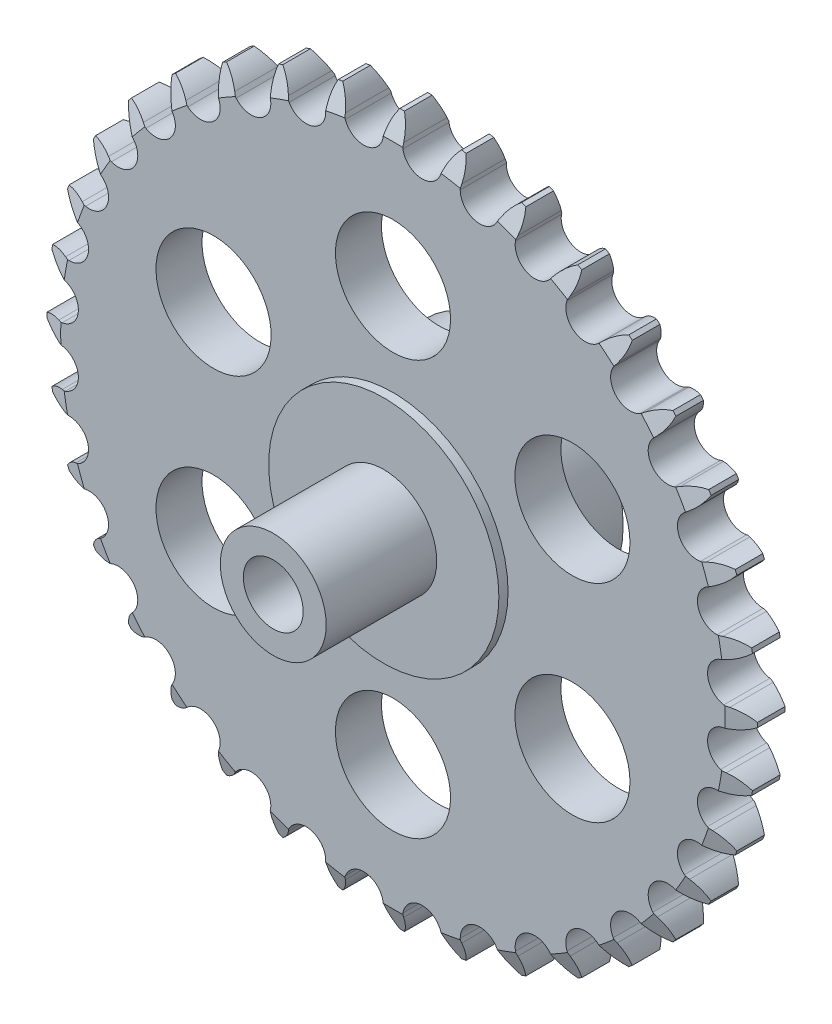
SolidWorks part; units mm, degrees
ref_plane "Front Plane" through (0, 0, 0) normal (0, 0, 1) x (1, 0, 0)
ref_plane "Top Plane" through (0, 0, 0) normal (0, 1, 0) x (1, 0, 0)
ref_plane "Right Plane" through (0, 0, 0) normal (1, 0, 0) x (0, 0, -1)
sketch "Sketch1" plane through (0, 0, 0) normal (0, 0, 1) x (1, 0, 0)
  line L0 (0, 0) -> (0, 72.8581) construction
  line L1 (-2.1568, 71.8581) -> (2.1568, 71.8581) construction
  line L2 (-2.1568, 71.8581) -> (-2.0429, 72.8581) construction
  line L3 (2.1568, 71.8581) -> (2.0429, 72.8581) construction
  line L4 (-2.0429, 72.8581) -> (2.0429, 72.8581) construction
  line L7 (-0.5, 77.163) -> (0.5, 77.163) construction
  circle A0 centre (0, 0) radius 72.8581 construction
  circle A1 centre (6.35, 72.5808) radius 4.255 construction
  circle A2 centre (-6.35, 72.5808) radius 4.255 construction
  circle A3 centre (0, 0) radius 68.6031 construction
  arc A4 (-2.0429, 72.8581) -> (-0.5, 77.163) centre (7.8928, 71.726) cw construction
  arc A5 (2.0429, 72.8581) -> (0.5, 77.163) centre (-7.8928, 71.726) ccw construction
  dimension "D1" = 13
  dimension "SprocketPitchDiameter" = 145.7162
  dimension "RollerDia" = 8.51
  dimension "D4" = 10
  dimension "ChainPitch" = 12.7
  dimension "D2" = 1
  dimension "D3" = 1
  dimension "D5" = 1
sketch "Sketch2" plane through (0, 0, 0) normal (0, 0, 1) x (1, 0, 0)
  circle A0 centre (0, 0) radius 68.6031 construction
  circle A1 centre (0, 0) radius 68.6031
extrude "Boss-Extrude1" add sketch "Sketch2" along normal mid plane 10
sketch "Sketch4" plane through (0, 0, 0) normal (0, 0, 1) x (1, 0, 0)
  line L0 (-0.5, 77.163) -> (0.5, 77.163) construction
  line L1 (-2.1568, 71.8581) -> (-2.0429, 72.8581) construction
  line L2 (2.1568, 71.8581) -> (2.0429, 72.8581) construction
  line L3 (-0.5, 77.163) -> (0.5, 77.163)
  line L4 (-2.1568, 71.8581) -> (-2.0429, 72.8581)
  line L5 (2.1568, 71.8581) -> (2.0429, 72.8581)
  circle A0 centre (0, 0) radius 68.6031 construction
  circle A1 centre (6.35, 72.5808) radius 4.255 construction
  circle A2 centre (-6.35, 72.5808) radius 4.255 construction
  arc A3 (2.0429, 72.8581) -> (0.5, 77.163) centre (-7.8928, 71.726) ccw construction
  arc A4 (-0.5, 77.163) -> (-2.0429, 72.8581) centre (7.8928, 71.726) ccw construction
  arc A5 (5.9792, 68.342) -> (-5.9792, 68.342) centre (0, 0) ccw
  arc A6 (2.1568, 71.8581) -> (5.9792, 68.342) centre (6.35, 72.5808) ccw
  arc A7 (-5.9792, 68.342) -> (-2.1568, 71.8581) centre (-6.35, 72.5808) ccw
  arc A8 (2.0429, 72.8581) -> (0.5, 77.163) centre (-7.8928, 71.726) ccw
  arc A9 (-0.5, 77.163) -> (-2.0429, 72.8581) centre (7.8928, 71.726) ccw
extrude "Boss-Extrude2" add sketch "Sketch4" along normal up to surface and the other way up to surface
pattern_circular "CirPattern1" count 36 over 360 about axis through (0, 0, 0) along (0, 0, 1) of "Boss-Extrude2"
sketch "Sketch5" plane through (0, 0, 0) normal (1, 0, 0) x (0, 0, -1)
  line L0 (0, 0) -> (-6, 0) construction
  line L1 (0, 77.163) -> (0, 72.8581) construction
  line L2 (-6, 84.663) -> (6, 84.663)
  line L3 (-6, 84.663) -> (-6, 69.663)
  line L4 (-6, 69.663) -> (6, 69.663) construction
  line L5 (6, 84.663) -> (6, 69.663)
  line L6 (-6, 84.663) -> (6, 69.663) construction
  line L7 (-6, 69.663) -> (6, 84.663) construction
  line L8 (-6, 69.663) -> (0, 84.663)
  line L9 (6, 69.663) -> (0, 84.663)
  line L10 (0, 77.163) -> (0, 72.8581) construction
  point P1 (0, 77.163)
  dimension "D1" = 15
  dimension "D2" = 1
revolve "Cut-Revolve7" cut sketch "Sketch5" angle 360 about L0
sketch "Sketch6" plane through (0, 0, 0) normal (0, 0, 1) x (1, 0, 0)
  circle A0 centre (0, 0) radius 25
  dimension "D1" = 50
extrude "Boss-Extrude3" add sketch "Sketch6" along normal blind 7 and the other way blind 20
sketch "Sketch7" plane through (0, 0, 0) normal (0, 0, 1) x (1, 0, 0)
  circle A0 centre (0, 0) radius 6.5
  dimension "D1" = 13
extrude "Cut-Extrude1" cut sketch "Sketch7" against normal through all both and the other way through all
sketch "Sketch8" plane through (0, 0, 7) normal (0, 0, 1) x (1, 0, 0)
  circle A1 centre (0, 0) radius 6.5 construction
  circle A2 centre (0, 0) radius 11.5
  circle A3 centre (0, 0) radius 11.5
  circle A4 centre (0, 0) radius 6.5
  dimension "D1" = 5
extrude "Boss-Extrude4" add sketch "Sketch8" along normal blind 24
sketch "Sketch9" plane through (0, 0, 5) normal (0, 0, 1) x (1, 0, 0)
  circle A0 centre (0, 45) radius 12.5
  dimension "D1" = 25
  dimension "D2" = 45
extrude "Cut-Extrude2" cut sketch "Sketch9" against normal through all
pattern_circular "CirPattern2" count 6 over 360 about axis through (0, 0, 0) along (0, 0, 1) of "Cut-Extrude2"
equation "\"ChainPitch\"=12.7"
equation "\"ChainPitch@Sketch1\"=\"ChainPitch\""
equation "\"SprocketPitchDiameter@Sketch1\" = \"ChainPitch\" / sin ( 180 / \"NumberOfTeeth\" )"
equation "\"NumberOfTeeth\"= 36"
equation "\"D1@CirPattern1\"=\"NumberOfTeeth\""
